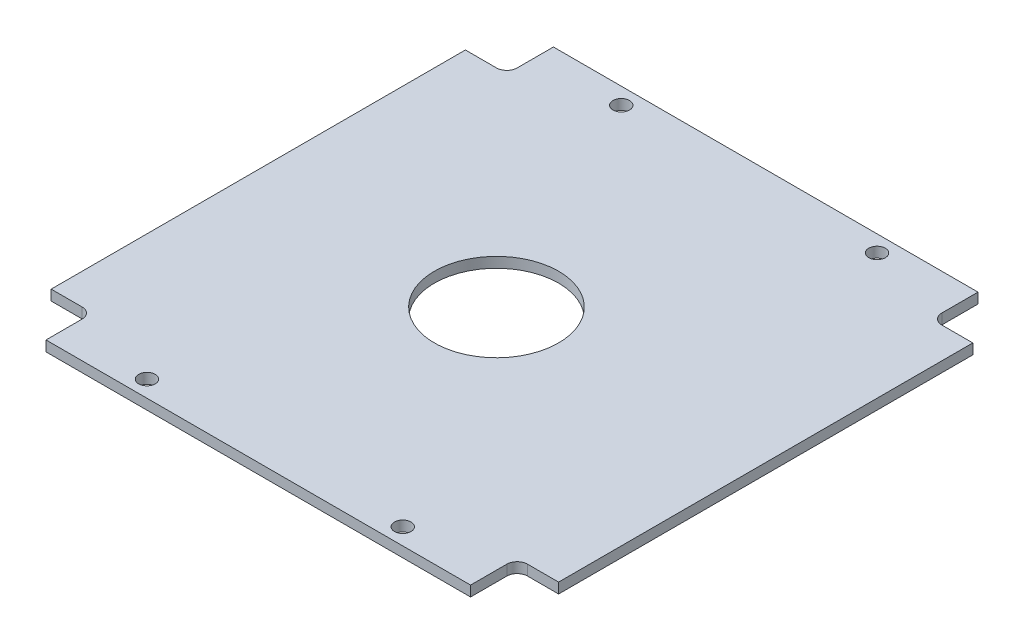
SolidWorks part; units mm, degrees
ref_plane "Front Plane" through (0, 0, 0) normal (0, 0, 1) x (1, 0, 0)
ref_plane "Top Plane" through (0, 0, 0) normal (0, 1, 0) x (1, 0, 0)
ref_plane "Right Plane" through (0, 0, 0) normal (1, 0, 0) x (0, 0, -1)
sketch "Sketch1" plane through (0, 0, 0) normal (0, 1, 0) x (1, 0, 0)
  line L0 (-49, 40) -> (-49, -40)
  line L1 (-49, -40) -> (-43, -40)
  line L2 (-41, -42) -> (-41, -49)
  line L3 (-41, -49) -> (41, -49)
  line L4 (41, -49) -> (41, -42)
  line L5 (43, -40) -> (49, -40)
  line L6 (49, -40) -> (49, 40)
  line L7 (49, 40) -> (43, 40)
  line L8 (41, 42) -> (41, 49)
  line L9 (41, 49) -> (-41, 49)
  line L10 (-41, 49) -> (-41, 42)
  line L11 (-43, 40) -> (-49, 40)
  arc A0 (-41, 42) -> (-43, 40) centre (-43, 42) cw
  arc A1 (43, 40) -> (41, 42) centre (43, 42) cw
  arc A2 (41, -42) -> (43, -40) centre (43, -42) cw
  arc A3 (-43, -40) -> (-41, -42) centre (-43, -42) cw
  point P15 (-41, 40)
  point P18 (41, 40)
  point P21 (41, -40)
  point P24 (-41, -40)
  dimension "D13" = 2
  dimension "D1" = 98
  dimension "D2" = 98
  dimension "D3" = 49
  dimension "D4" = 49
  dimension "D5" = 9
  dimension "D6" = 8
  dimension "D7" = 9
  dimension "D8" = 8
  dimension "D9" = 9
  dimension "D10" = 8
  dimension "D11" = 8
  dimension "D12" = 9
extrude "Boss-Extrude1" add sketch "Sketch1" along normal blind 2
hole_wizard "Ø3.2 (3.2) Diameter Hole1" positions "Sketch3" profile "Sketch2" hole size "Ø3.2" standard "ISO"
sketch "Sketch3" plane through (0, 2, 0) normal (0, 1, 0) x (1, 0, 0)
  line L0 (41, 49) -> (-41, 49) construction
  line L1 (-41, 49) -> (-41, 42) construction
  line L2 (41, 42) -> (41, 49) construction
  line L3 (-41, -49) -> (41, -49) construction
  line L4 (-41, -42) -> (-41, -49) construction
  line L5 (41, -49) -> (41, -42) construction
  point P0 (24.7, 45.8)
  point P2 (-24.7, 45.8)
  point P4 (-24.7, -45.8)
  point P6 (24.7, -45.8)
  dimension "D1" = 3.2
  dimension "D2" = 16.3
  dimension "D3" = 16.3
  dimension "D4" = 3.2
  dimension "D5" = 16.3
  dimension "D6" = 16.3
sketch "Sketch2" plane through (24.7, 2, -45.8) normal (1, 0, 0) x (0, 0, 1)
  line L0 (0, 0) -> (0, 2)
  line L1 (0, 2) -> (1.6, 2)
  line L2 (1.6, 2) -> (1.6, 0)
  line L5 (1.6, 0) -> (0, 0)
  line L11 (0, -6.35) -> (0, 107.95) construction
  dimension "Thru Hole Dia." = 3.2
  dimension "Thru Hole Depth" = 2
sketch "Sketch4" plane through (0, 0, 0) normal (0, -1, 0) x (1, 0, 0)
  line L0 (49, 40) -> (49, -40) construction
  circle A0 centre (-3, 0) radius 12
  dimension "D1" = 24
  dimension "D2" = 52
extrude "Cut-Extrude1" cut sketch "Sketch4" against normal blind 10
